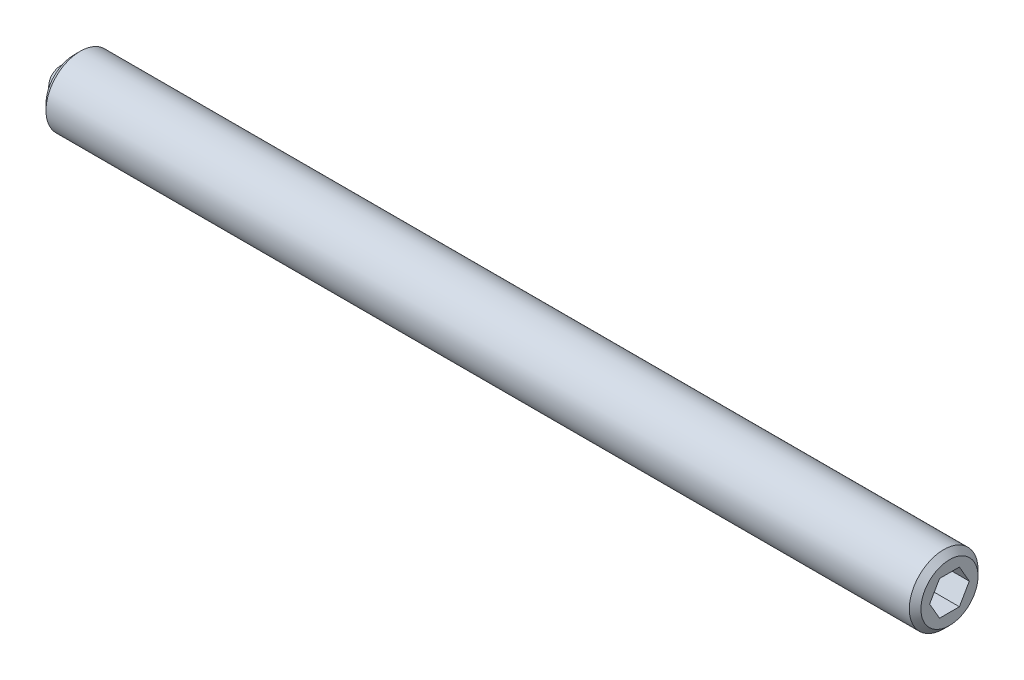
SolidWorks part; units mm, degrees
ref_plane "Front Plane" through (0, 0, 0) normal (0, 0, 1) x (1, 0, 0)
ref_plane "Top Plane" through (0, 0, 0) normal (0, 1, 0) x (1, 0, 0)
ref_plane "Right Plane" through (0, 0, 0) normal (1, 0, 0) x (0, 0, -1)
sketch "Sketch2" plane through (0, 0, 0) normal (1, 0, 0) x (0, 0, -1)
  circle A0 centre (0, 0) radius 1.5
  dimension "D1" = 3
extrude "Boss-Extrude1" add sketch "Sketch2" along normal blind 38.2
sketch "Sketch3" plane through (0, 0, 0) normal (-1, 0, 0) x (0, 0, 1)
  circle A0 centre (0, 0) radius 0.8
  dimension "D1" = 1.6
chamfer "Chamfer1" distance 0.254 angle 45 1 edges at (0, 0, -1.5)
chamfer "Chamfer2" distance 0.254 angle 45 1 edges at (38.2, 0, -1.5)
sketch "Sketch4" plane through (38.2, 0, 0) normal (1, 0, 0) x (0, 0, -1)
  line L1 (0.866, 0) -> (0.433, 0.75)
  line L2 (0.433, 0.75) -> (-0.433, 0.75)
  line L3 (-0.433, 0.75) -> (-0.866, 0)
  line L4 (-0.866, 0) -> (-0.433, -0.75)
  line L5 (-0.433, -0.75) -> (0.433, -0.75)
  line L6 (0.433, -0.75) -> (0.866, 0)
  circle A0 centre (0, 0) radius 0.75 construction
  dimension "D1" = 1.5
extrude "Cut-Extrude2" cut sketch "Sketch4" against normal blind 2
extrude "Cut-Extrude3" cut sketch "Sketch3" against normal blind 0.8
sketch "Sketch5" plane through (0, 0, 0) normal (-1, 0, 0) x (0, 0, 1)
  line L0 (0, 0) -> (0, -0.8)
  line L1 (0, 0) -> (0, 0.8)
  arc A0 (0, 0.8) -> (0, -0.8) centre (0, 0) ccw
  dimension "D1" = 0.8
revolve "Revolve1" add sketch "Sketch5" angle 360 about L1
